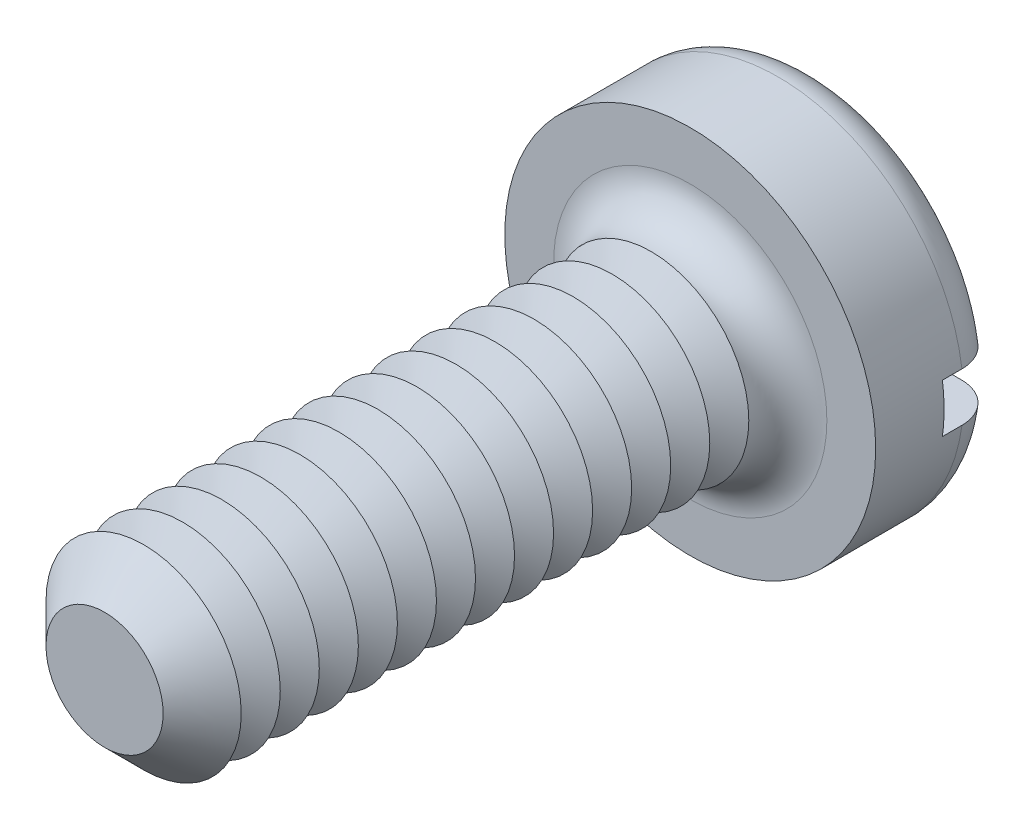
SolidWorks part; units mm, degrees
ref_plane "Front Plane" through (0, 0, 0) normal (0, 0, 1) x (1, 0, 0)
ref_plane "Top Plane" through (0, 0, 0) normal (0, 1, 0) x (1, 0, 0)
ref_plane "Right Plane" through (0, 0, 0) normal (1, 0, 0) x (0, 0, -1)
sketch "Sketch3" plane through (0, 0, 0) normal (0, 0, 1) x (1, 0, 0)
  circle A0 centre (0, 0) radius 1.9
  dimension "D1" = 3.8
extrude "Boss-Extrude2" add sketch "Sketch3" against normal blind 1.3
sketch "Sketch4" plane through (0, 0, 0) normal (0, 0, 1) x (1, 0, 0)
  circle A0 centre (0, 0) radius 1
  dimension "D1" = 2
extrude "Boss-Extrude3" add sketch "Sketch4" along normal blind 6
fillet "Fillet1" radius 0.4 2 edges at (1.9, 0, -1.3) (1, 0, 0)
chamfer "Chamfer1" distance 0.4 angle 45 1 edges at (1, 0, 6)
sketch "Sketch5" plane through (0, 0, 0) normal (1, 0, 0) x (0, 0, -1)
  line L0 (1.6944, 0) -> (-7.6738, 0) construction
sketch "Sketch6" plane through (0, 0, 0) normal (1, 0, 0) x (0, 0, -1)
  line L0 (-0.4, 1) -> (-0.6, 0.6536)
  line L1 (-0.6, 0.6536) -> (-0.8, 1)
  line L2 (-0.4, 1) -> (-5.6, 1) construction
  line L3 (-0.8, 1) -> (-0.4, 1)
  dimension "D1" = 0.4
revolve "Cut-Revolve1" cut sketch "Sketch6" angle 360 about L0
pattern_linear "LPattern1" count 13 spacing 0.4 along (0, 0, 1) of "Cut-Revolve1"
sketch "Sketch8" plane through (0, 0, -1.3) normal (0, 0, -1) x (-1, 0, 0)
  line L1 (1.9, -0.25) -> (-1.9, -0.25)
  line L2 (1.9, -0.25) -> (1.9, 0.25)
  line L3 (1.9, 0.25) -> (-1.9, 0.25)
  line L4 (-1.9, -0.25) -> (-1.9, 0.25)
  line L5 (1.9, -0.25) -> (-1.9, 0.25) construction
  line L6 (1.9, 0.25) -> (-1.9, -0.25) construction
  point P0 (0, 0)
  dimension "D1" = 3.8
  dimension "D2" = 0.5
extrude "Cut-Extrude1" cut sketch "Sketch8" against normal blind 0.6
